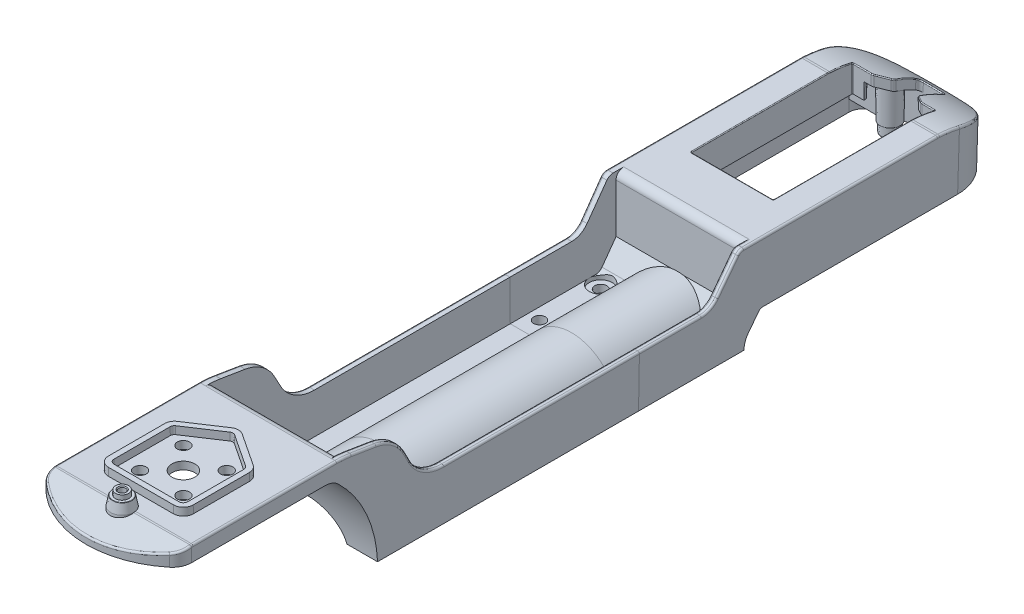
SolidWorks part; units mm, degrees
other "Solido1"
ref_plane "前视基准面" through (0, 0, 0) normal (0, 0, 1) x (1, 0, 0)
ref_plane "上视基准面" through (0, 0, 0) normal (0, 1, 0) x (1, 0, 0)
ref_plane "右视基准面" through (0, 0, 0) normal (1, 0, 0) x (0, 0, -1)
imported_body "Imported1"
other "移动面1" parameters "D1"=0.15
other "移动面2" parameters "D1"=0.15
other "移动面4" parameters "D1"=0.15
fillet "Fillet1" radius 0.5 3 edges
sketch "Sketch1" plane through (-17.8349, -0.3113, 0) normal (-0.9998, -0.0175, 0) x (0, 0, 1)
  line L0 (61.6381, -19.1916) -> (61.6381, -6.1984) construction
  line L1 (34.1121, -19.1916) -> (79.8, -19.1916) construction
  line L2 (62.6964, -6.1984) -> (45.4947, -6.1984) construction
ref_plane "Plane1" through (0, 0, 61.6381) normal (0, 0, 1) x (1, 0, 0)
split "Split1" bodies to split 119 resulting bodies 120 121
sketch "Sketch2" plane through (-17.8349, -0.3113, 0) normal (-0.9998, -0.0175, 0) x (0, 0, 1)
  line L0 (62.6964, -6.1984) -> (62.6964, -19.1916) construction
  line L1 (34.1121, -19.1916) -> (79.8, -19.1916) construction
ref_plane "Plane2" through (0.0001, 0, 62.6964) normal (0, 0, 1) x (1, 0, 0)
sketch "Sketch5" plane through (0, -19.5, 0) normal (0, -1, 0) x (1, 0, 0)
  line L0 (-17.5, 61.6381) -> (17.5, 61.6381) construction
  line L1 (17.5, 79.8) -> (17.5, 34.1121) construction
ref_plane "Plane3" through (0, 0, 61.6381) normal (0, 0, 1) x (1, 0, 0)
split "Split3" trim tools "Plane3" bodies to split 121 resulting bodies 125 126
move or copy body "Body-Move/Copy2" bodies to move or copy 126 copy no translate (0, 0, -50)
sketch "Sketch6" plane through (0, 0, 61.6381) normal (0, 0, -1) x (-1, 0, 0)
  line L10 (17.2268, -6) -> (16.0916, -6)
  line L11 (16.0916, -6) -> (16, -16.5)
  line L12 (16, -16.5) -> (10.3923, -16.5)
  line L13 (-10.3947, -16.5008) -> (-16, -16.5)
  line L14 (-16, -16.5) -> (-16.0873, -6.4956)
  line L15 (-16.5873, -6) -> (-17.2268, -6)
  line L16 (-17.7268, -6.5087) -> (-17.5, -19.5)
  line L17 (-17.5, -19.5) -> (-9.5394, -19.5)
  line L18 (9.5394, -19.5) -> (17.5, -19.5)
  line L19 (17.5, -19.5) -> (17.7268, -6.5087)
  line L20 (17.2268, -6) -> (16.0916, -6)
  line L21 (16.0916, -6) -> (16, -16.5)
  line L22 (16, -16.5) -> (10.3923, -16.5)
  line L23 (-10.3947, -16.5008) -> (-16, -16.5)
  line L24 (-16, -16.5) -> (-16.0873, -6.4956)
  line L25 (-16.5873, -6) -> (-17.2268, -6)
  line L26 (-17.7268, -6.5087) -> (-17.5, -19.5)
  line L27 (-17.5, -19.5) -> (-9.5394, -19.5)
  line L28 (9.5394, -19.5) -> (17.5, -19.5)
  line L29 (17.5, -19.5) -> (17.7268, -6.5087)
  arc A4 (17.7268, -6.5087) -> (17.2268, -6) centre (17.2268, -6.5) ccw
  arc A5 (10.3923, -16.5) -> (-10.3947, -16.5008) centre (-0.001, -22.5) ccw
  arc A6 (-16.0873, -6.4956) -> (-16.5873, -6) centre (-16.5873, -6.5) ccw
  arc A7 (-17.2268, -6) -> (-17.7268, -6.5087) centre (-17.2268, -6.5) ccw
  arc A8 (9.5394, -19.5) -> (-9.5394, -19.5) centre (0, -22.5) ccw
  arc A9 (17.7268, -6.5087) -> (17.2268, -6) centre (17.2268, -6.5) ccw
  arc A10 (10.3923, -16.5) -> (-10.3947, -16.5008) centre (-0.001, -22.5) ccw
  arc A11 (-16.0873, -6.4956) -> (-16.5873, -6) centre (-16.5873, -6.5) ccw
  arc A12 (-17.2268, -6) -> (-17.7268, -6.5087) centre (-17.2268, -6.5) ccw
  arc A13 (9.5394, -19.5) -> (-9.5394, -19.5) centre (0, -22.5) ccw
  dimension "D1" = 0
extrude "Boss-Extrude1" add sketch "Sketch6" along normal blind 50
